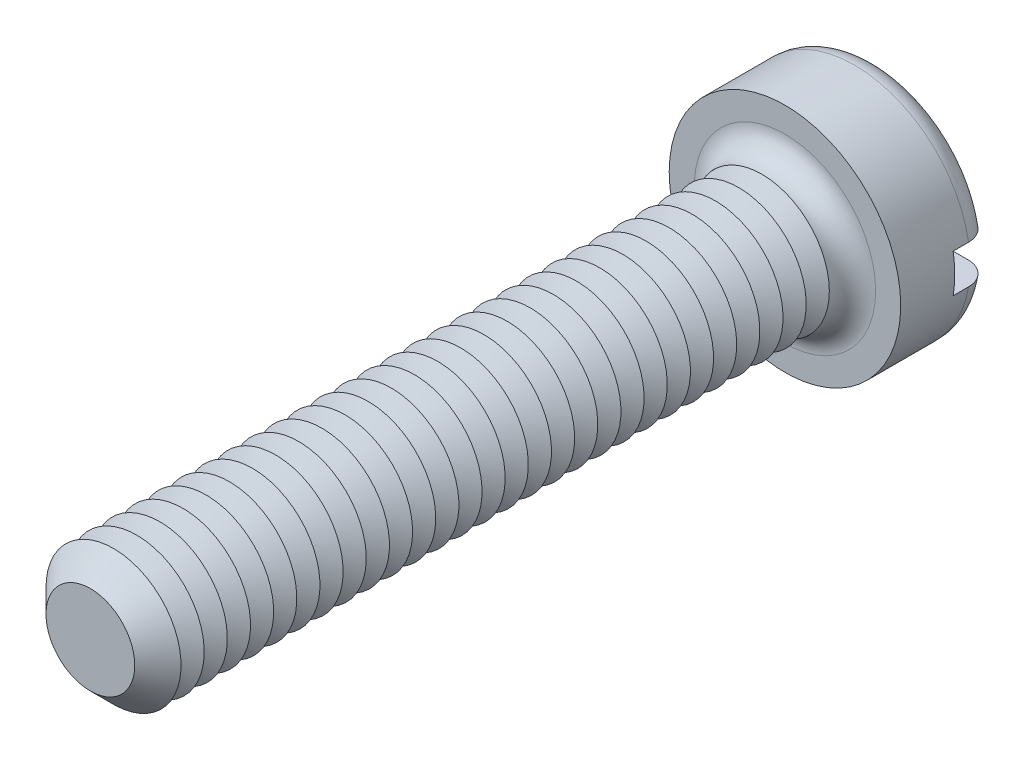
SolidWorks part; units mm, degrees
ref_plane "Front Plane" through (0, 0, 0) normal (0, 0, 1) x (1, 0, 0)
ref_plane "Top Plane" through (0, 0, 0) normal (0, 1, 0) x (1, 0, 0)
ref_plane "Right Plane" through (0, 0, 0) normal (1, 0, 0) x (0, 0, -1)
sketch "Sketch3" plane through (0, 0, 0) normal (0, 0, 1) x (1, 0, 0)
  circle A0 centre (0, 0) radius 3
  dimension "D1" = 6
extrude "Boss-Extrude2" add sketch "Sketch3" against normal blind 2.4
sketch "Sketch4" plane through (0, 0, 0) normal (0, 0, 1) x (1, 0, 0)
  circle A0 centre (0, 0) radius 1.75
  dimension "D1" = 3.5
extrude "Boss-Extrude3" add sketch "Sketch4" along normal blind 18
fillet "Fillet1" radius 0.6 2 edges at (3, 0, -2.4) (1.75, 0, 0)
chamfer "Chamfer1" distance 0.6 angle 45 1 edges at (1.75, 0, 18)
sketch "Sketch5" plane through (0, 0, 0) normal (1, 0, 0) x (0, 0, -1)
  line L0 (1.6944, 0) -> (-7.6738, 0) construction
sketch "Sketch6" plane through (0, 0, 0) normal (1, 0, 0) x (0, 0, -1)
  line L0 (-0.6, 1.75) -> (-0.9, 1.2304)
  line L1 (-0.9, 1.2304) -> (-1.2, 1.75)
  line L2 (-0.6, 1.75) -> (-17.4, 1.75) construction
  line L3 (-1.2, 1.75) -> (-0.6, 1.75)
  dimension "D1" = 0.6
revolve "Cut-Revolve1" cut sketch "Sketch6" angle 360 about L0
pattern_linear "LPattern1" count 28 spacing 0.6 along (0, 0, 1) of "Cut-Revolve1"
sketch "Sketch8" plane through (0, 0, -2.4) normal (0, 0, -1) x (-1, 0, 0)
  line L1 (3, -0.5) -> (-3, -0.5)
  line L2 (3, -0.5) -> (3, 0.5)
  line L3 (3, 0.5) -> (-3, 0.5)
  line L4 (-3, -0.5) -> (-3, 0.5)
  line L5 (3, -0.5) -> (-3, 0.5) construction
  line L6 (3, 0.5) -> (-3, -0.5) construction
  point P0 (0, 0)
  dimension "D1" = 6
  dimension "D2" = 1
extrude "Cut-Extrude1" cut sketch "Sketch8" against normal blind 1
